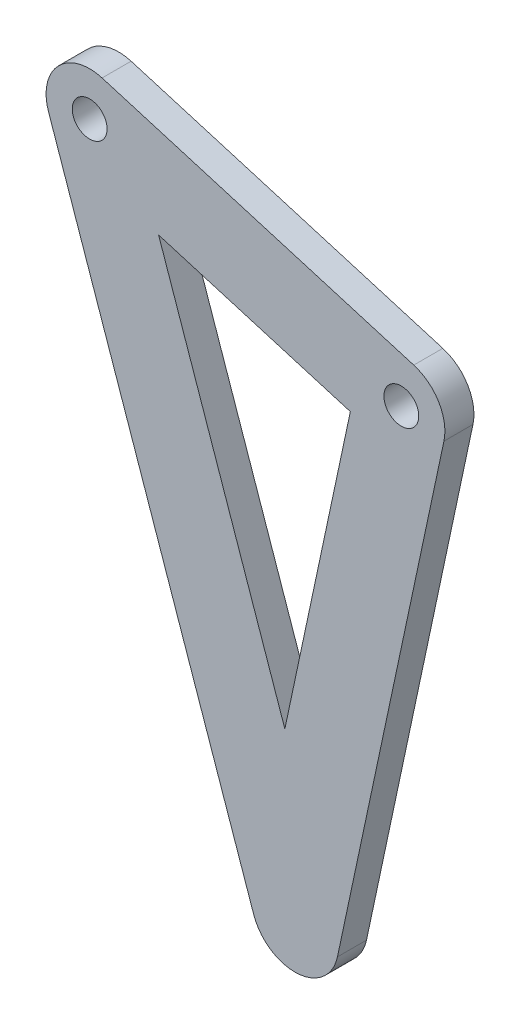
SolidWorks part; units mm, degrees
ref_plane "Plan de face" through (0, 0, 0) normal (0, 0, 1) x (1, 0, 0)
ref_plane "Plan de dessus" through (0, 0, 0) normal (0, 1, 0) x (1, 0, 0)
ref_plane "Plan de droite" through (0, 0, 0) normal (1, 0, 0) x (0, 0, -1)
sketch "Esquisse1" plane through (0, 0, 0) normal (0, 0, 1) x (1, 0, 0)
  line L0 (-138.3093, -40.0719) -> (-84.6394, -56.0578) construction
  line L1 (-136.1683, -32.884) -> (-82.4985, -48.8699)
  line L2 (-140.4503, -47.2599) -> (-86.7804, -63.2457)
  line L3 (-84.6394, -56.0578) -> (-102.9717, -142.1271) construction
  line L4 (-77.304, -57.6202) -> (-95.6363, -143.6895)
  line L5 (-91.9749, -54.4954) -> (-110.3072, -140.5647)
  line L6 (-102.9717, -142.1271) -> (-138.3093, -40.0719) construction
  line L7 (-110.0589, -144.5811) -> (-145.3965, -42.5259)
  line L8 (-95.8846, -139.6731) -> (-131.2221, -37.6179)
  line L9 (-126.4384, -51.4334) -> (-104.6967, -114.2236)
  line L10 (-104.6967, -114.2236) -> (-93.4176, -61.2688)
  line L11 (-93.4176, -61.2688) -> (-126.4384, -51.4334)
  line L12 (-77.304, -57.6202) -> (-95.6363, -143.6895)
  line L13 (-136.1683, -32.884) -> (-82.4985, -48.8699)
  line L14 (-145.3965, -42.5259) -> (-110.0589, -144.5811)
  arc A0 (-136.1683, -32.884) -> (-140.4503, -47.2599) centre (-138.3093, -40.0719) ccw
  arc A1 (-86.7804, -63.2457) -> (-82.4985, -48.8699) centre (-84.6394, -56.0578) ccw
  arc A2 (-77.304, -57.6202) -> (-91.9749, -54.4954) centre (-84.6394, -56.0578) ccw
  arc A3 (-110.3072, -140.5647) -> (-95.6363, -143.6895) centre (-102.9717, -142.1271) ccw
  arc A4 (-110.0589, -144.5811) -> (-95.8846, -139.6731) centre (-102.9717, -142.1271) ccw
  arc A5 (-131.2221, -37.6179) -> (-145.3965, -42.5259) centre (-138.3093, -40.0719) ccw
  point P4 (-111.4744, -48.0649)
  point P9 (-93.8056, -99.0924)
  point P18 (-120.6405, -91.0995)
  point P25 (-126.4384, -51.4334)
  point P26 (-104.6967, -114.2236)
  point P27 (-93.4176, -61.2688)
  dimension "D1" = 15
  dimension "D2" = 15
  dimension "D3" = 15
extrude "Boss.-Extru.1" add sketch "Esquisse1" against normal blind 5 contours A5 L8 L2 L5 A2 L1 | A1 A2 L5 L2 | L8 A5 A0 L2 | A3 L5 L8 L2 A0 L7 | A3 A4 L8 L5 | A4 L4 A1 L2 L5 L8
sketch "Esquisse2" plane through (0, 0, 0) normal (0, 0, 1) x (1, 0, 0)
  circle A0 centre (-84.6394, -56.0578) radius 3
  circle A1 centre (-138.3093, -40.0719) radius 3
  dimension "D1" = 6
  dimension "D2" = 6
extrude "Enlèv. mat.-Extru.1" cut sketch "Esquisse2" against normal through all both and the other way through all contours A1 | A0
